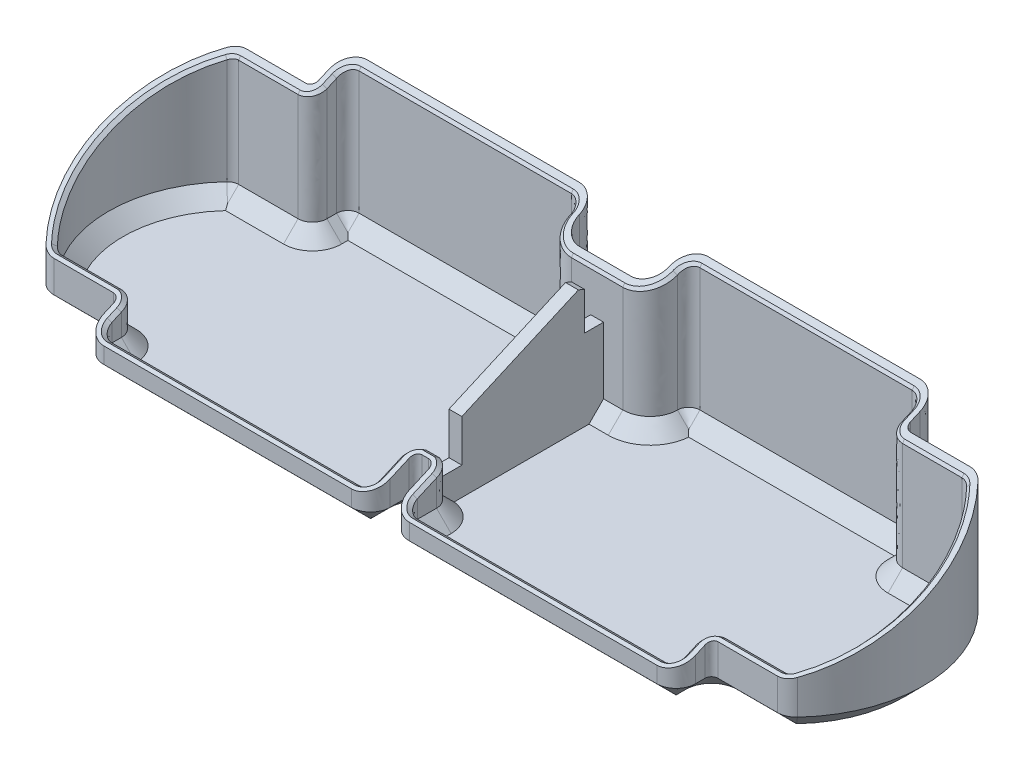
SolidWorks part; units mm, degrees
ref_plane "Ebene vorne" through (0, 0, 0) normal (0, 0, 1) x (1, 0, 0)
ref_plane "Ebene oben" through (0, 0, 0) normal (0, 1, 0) x (1, 0, 0)
ref_plane "Ebene rechts" through (0, 0, 0) normal (1, 0, 0) x (0, 0, -1)
sketch "Skizze1" plane through (0, 0, 0) normal (0, 1, 0) x (1, 0, 0)
  line L1 (-43.5, 20.5) -> (43.5, 20.5)
  line L3 (-43.5, -20.5) -> (43.5, -20.5)
  line L5 (-43.5, 20.5) -> (43.5, -20.5) construction
  line L6 (-43.5, -20.5) -> (43.5, 20.5) construction
  arc A0 (43.5, -20.5) -> (43.5, 20.5) centre (43.5, 0) ccw
  arc A1 (-43.5, -20.5) -> (-43.5, 20.5) centre (-43.5, 0) cw
  point P0 (0, 0)
  point P8 (-64, 0)
  point P9 (64, 0)
  dimension "D1" = 41
  dimension "D2" = 128
extrude "Aufsatz-Linear austragen1" add sketch "Skizze1" along normal blind 23.5
sketch "Skizze2" plane through (0, 0, 0) normal (1, 0, 0) x (0, 0, -1)
  line L0 (20.5, 23.5) -> (-20.5, 5.5)
  line L1 (-20.5, 23.5) -> (-20.5, 0) construction
  line L5 (-20.5, 0) -> (20.5, 0) construction
  line L6 (20.5, 23.5) -> (-20.5, 23.5)
  line L7 (-20.5, 23.5) -> (-20.5, 5.5)
  dimension "D1" = 5.5
extrude "Schnitt-Linear austragen1" cut sketch "Skizze2" against normal through all both and the other way through all
sketch "Skizze4" plane through (0, 0, 0) normal (0, -1, 0) x (1, 0, 0)
  line L0 (0, 0) -> (80.5126, 0) construction
  line L1 (66, 25) -> (46, 25)
  line L2 (66, 25) -> (66, 15)
  line L3 (66, 15) -> (46, 15)
  line L4 (46, 25) -> (46, 15)
  line L5 (66, 25) -> (46, 15) construction
  line L6 (66, 15) -> (46, 25) construction
  line L7 (66, -15) -> (46, -15)
  line L8 (66, -15) -> (66, -25)
  line L9 (66, -25) -> (46, -25)
  line L10 (46, -15) -> (46, -25)
  line L11 (66, -15) -> (46, -25) construction
  line L12 (66, -25) -> (46, -15) construction
  point P0 (56, 20)
  point P5 (56, -20)
  dimension "D1" = 30
  dimension "D2" = 46
  dimension "D3" = 10
  dimension "D4" = 10
  dimension "D5" = 20
  dimension "D6" = 20
extrude "Schnitt-Linear austragen2" cut sketch "Skizze4" against normal through all
mirror "Spiegeln1" about plane through (0, 0, 0) normal (1, 0, 0) of "Schnitt-Linear austragen2"
sketch "Skizze5" plane through (0, 0, 0) normal (0, -1, 0) x (1, 0, 0)
  line L1 (-1.5, 13.5) -> (1.5, 13.5)
  line L2 (-1.5, 13.5) -> (-1.5, 28.5)
  line L3 (-1.5, 28.5) -> (1.5, 28.5)
  line L4 (1.5, 13.5) -> (1.5, 28.5)
  line L5 (-1.5, 13.5) -> (1.5, 28.5) construction
  line L6 (-1.5, 28.5) -> (1.5, 13.5) construction
  line L7 (0, 0) -> (0, 28.5) construction
  line L8 (-43.5, 20.5) -> (43.5, 20.5) construction
  point P0 (0, 21)
  dimension "D1" = 7
  dimension "D2" = 3
  dimension "D3" = 15
extrude "Schnitt-Linear austragen4" cut sketch "Skizze5" against normal blind 24.5
sketch "Skizze6" plane through (0, 0, 0) normal (0, -1, 0) x (1, 0, 0)
  line L0 (43.5, -20.5) -> (-43.5, -20.5) construction
  line L1 (-7, -14.5) -> (7, -14.5)
  line L2 (-7, -14.5) -> (-7, -29.5)
  line L3 (-7, -29.5) -> (7, -29.5)
  line L4 (7, -14.5) -> (7, -29.5)
  line L5 (-7, -14.5) -> (7, -29.5) construction
  line L6 (-7, -29.5) -> (7, -14.5) construction
  line L7 (0, 0) -> (0, -14.5) construction
  point P0 (0, -22)
  dimension "D1" = 14
  dimension "D2" = 6
  dimension "D3" = 15
extrude "Schnitt-Linear austragen5" cut sketch "Skizze6" against normal through all
fillet "Verrundung1" radius 3 14 edges at (-7, 10.4329, -14.5) (7, 10.4329, -14.5) (7, 11.75, -20.5) (-7, 11.75, -20.5) (-46, 11.7164, -20.347) (-57.4732, 10.5427, -15) (-57.4732, 3.9573, 15) (-46, 2.7836, 20.347) (-1.5, 2.75, 20.5) (1.5, 2.75, 20.5) (46, 2.7836, 20.347) (57.4732, 3.9573, 15) (57.4732, 10.5427, -15) (46, 11.7164, -20.347)
fillet "Verrundung2" radius 1 2 edges at (1.5, 4.2866, 13.5) (-1.5, 4.2866, 13.5)
fillet "Verrundung3" radius 1 4 edges at (46, 3.9573, 15) (46, 10.5427, -15) (-46, 10.5427, -15) (-46, 3.9573, 15)
chamfer "Fase2" distance 3 angle 45 38 edges at (-46.2929, 0, 15.2929) (-46, 0, 16.75) (-51.6189, 0, 15) (-45.1213, 0, 19.6213) (-57.427, 0, 14.7542) (-23.75, 0, 20.5) (-64, 0, 0) (-2.3787, 0, 19.6213) (-57.427, 0, -14.7542) (-1.5, 0, 16) (-51.6189, 0, -15) (-1.2071, 0, 13.7929) (-46.2929, 0, -15.2929) (0, 0, 13.5) (-46, 0, -16.75) (1.2071, 0, 13.7929) (-45.1213, 0, -19.6213) (1.5, 0, 16) (-26.5, 0, -20.5) (2.3787, 0, 19.6213) (-7.8787, 0, -19.6213) (23.75, 0, 20.5) (-6.1213, 0, -15.3787) (45.1213, 0, 19.6213) (0, 0, -14.5) (46, 0, 16.75) (6.1213, 0, -15.3787) (46.2929, 0, 15.2929) (7.8787, 0, -19.6213) (51.6189, 0, 15) (26.5, 0, -20.5) (57.427, 0, 14.7542) (45.1213, 0, -19.6213) (64, 0, 0) (46, 0, -16.75) (57.427, 0, -14.7542) (46.2929, 0, -15.2929) (51.6189, 0, -15)
shell "Wandung3" thickness 1.25
sketch "Skizze7" plane through (0, 0, 0) normal (1, 0, 0) x (0, 0, -1)
  line L0 (-12.25, 9.122) -> (13.25, 20.3171)
rib "Verstärkungsrippe1" sketch "Skizze7" sketch "Skizze7" thickness 2 extrusion direction parallel to sketch draft on no parameters "D1"=2
sketch "Skizze8" plane through (1, 0, 0) normal (1, 0, 0) x (0, 0, -1)
  line L0 (13.25, 3.5178) -> (13.25, 20.3171) construction
  line L1 (-8.8063, 10.6338) -> (-12.3063, 10.6338)
  line L2 (-8.8063, 10.6338) -> (-8.8063, 5.5973)
  line L3 (-8.8063, 5.5973) -> (-12.3063, 5.5973)
  line L4 (-12.3063, 10.6338) -> (-12.3063, 5.5973)
  line L5 (-8.8063, 10.6338) -> (-12.3063, 5.5973) construction
  line L6 (-8.8063, 5.5973) -> (-12.3063, 10.6338) construction
  line L7 (10.25, 20.3171) -> (13.25, 20.3171)
  line L8 (10.25, 20.3171) -> (10.25, 13.8171)
  line L9 (10.25, 13.8171) -> (13.25, 13.8171)
  line L10 (13.25, 20.3171) -> (13.25, 13.8171)
  line L11 (10.25, 20.3171) -> (13.25, 13.8171) construction
  line L12 (10.25, 13.8171) -> (13.25, 20.3171) construction
  line L13 (-12.3063, 9.0973) -> (13.25, 20.3171) construction
  line L14 (-12.3063, 9.0973) -> (-12.3063, 3.5178) construction
  point P0 (-10.5563, 8.1155)
  point P5 (11.75, 17.0671)
  dimension "D1" = 3
  dimension "D2" = 6.5
  dimension "D3" = 3.5
  dimension "D4" = 3.5
extrude "Schnitt-Linear austragen6" cut sketch "Skizze8" against normal up to next
fillet "Fase4" radius 0.5 38 edges at (0, 9.0973, 12.3063) (2.2589, 8.7502, 13.0969) (2.75, 7.4756, 16) (3.2626, 6.2738, 18.7374) (23.75, 6.0488, 19.25) (44.2374, 6.2738, 18.7374) (44.75, 7.1463, 16.75) (45.409, 8.1741, 14.409) (51.6189, 8.4634, 13.75) (56.9315, 8.5264, 13.6066) (62.75, 14.5, 0) (56.9315, 20.4736, -13.6066) (51.6189, 20.5366, -13.75) (45.409, 20.8259, -14.409) (44.75, 21.8537, -16.75) (-2.2589, 8.7502, 13.0969) (44.2374, 22.7262, -18.7374) (-2.75, 7.4756, 16) (26.5, 22.9512, -19.25) (-3.2626, 6.2738, 18.7374) (8.7626, 22.7262, -18.7374) (-23.75, 6.0488, 19.25) (7.0052, 20.8636, -14.4948) (-44.2374, 6.2738, 18.7374) (0, 20.3171, -13.25) (-44.75, 7.1463, 16.75) (-7.0052, 20.8636, -14.4948) (-45.409, 8.1741, 14.409) (-8.7626, 22.7262, -18.7374) (-51.6189, 8.4634, 13.75) (-26.5, 22.9512, -19.25) (-56.9315, 8.5264, 13.6066) (-44.2374, 22.7262, -18.7374) (-62.75, 14.5, 0) (-44.75, 21.8537, -16.75) (-56.9315, 20.4736, -13.6066) (-45.409, 20.8259, -14.409) (-51.6189, 20.5366, -13.75)
scale "Skalieren1" scale about centroid uniform scaling no x scale factor 1.00115 y scale factor 1.00375 z scale factor 1
sketch "Skizze9" plane through (1.0011, 0, 0) normal (1, 0, 0) x (0, 0, -1)
  line L0 (10.25, 19.0506) -> (10.25, 20.5506)
  line L1 (10.25, 20.5506) -> (-8.8063, 12.153)
  line L2 (-8.8063, 12.153) -> (-8.8063, 10.653)
  line L3 (-8.8063, 10.653) -> (10.25, 19.0506) construction
  line L4 (10.25, 19.0506) -> (-8.8063, 10.653)
  dimension "D1" = 1.5
extrude "Aufsatz-Linear austragen2" add sketch "Skizze9" against normal up to surface (2.0023 mm away)
chamfer "Fase5" distance 1 angle 45 1 edges at (0, 20.5506, -10.25)
